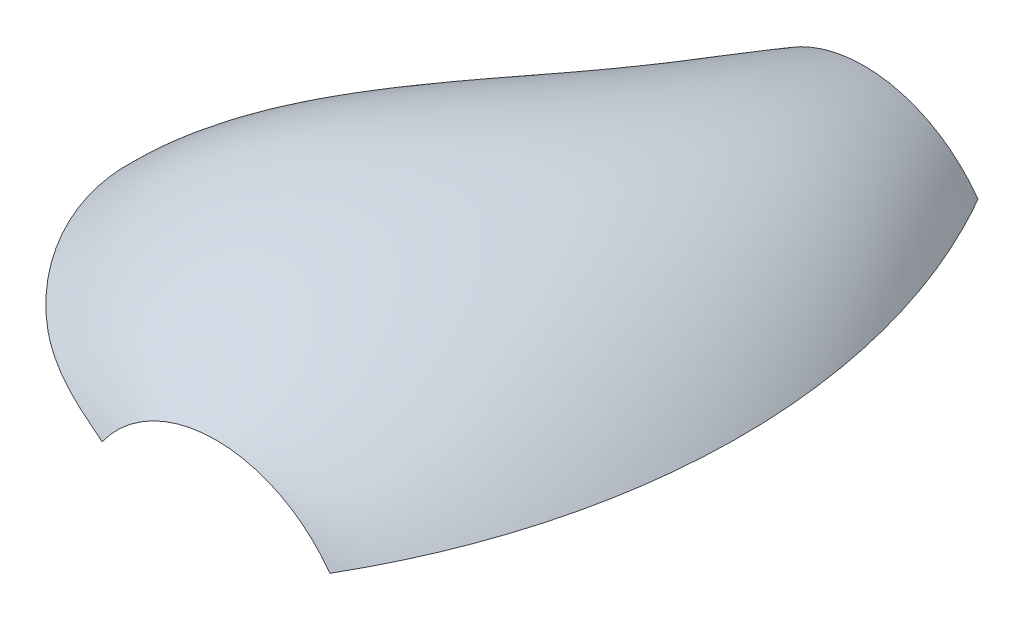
SolidWorks part; units mm, degrees
ref_plane "Front" through (0, 0, 0) normal (0, 0, 1) x (1, 0, 0)
ref_plane "Top" through (0, 0, 0) normal (0, 1, 0) x (1, 0, 0)
ref_plane "Right" through (0, 0, 0) normal (1, 0, 0) x (0, 0, -1)
sketch "Sketch1" plane through (0, 0, 0) normal (0, 1, 0) x (1, 0, 0)
  line L0 (0, 0) -> (0, 100)
  dimension "D1" = 100
sketch "Sketch2" plane through (0, 0, 0) normal (0, 1, 0) x (1, 0, 0)
  arc A0 (20, 0) -> (20, 100) centre (-66.6025, 50) ccw
  dimension "D1" = 100
  dimension "D2" = 20
sketch "Sketch3" plane through (0, 0, 0) normal (0, 1, 0) x (1, 0, 0)
  spline_without_curve S0
sketch "Sketch4" plane through (0, 0, 0) normal (1, 0, 0) x (0, 0, -1)
  arc A0 (0, 8.8986) -> (100, 8.8986) centre (50, -135.8684) cw
sketch "Sketch5" plane through (0, 0, 0) normal (0, 0, 1) x (1, 0, 0)
  arc A0 (-15.1464, 0) -> (20, 0) centre (2.4268, -12.5719) cw
surface "Surface-Sweep3"
